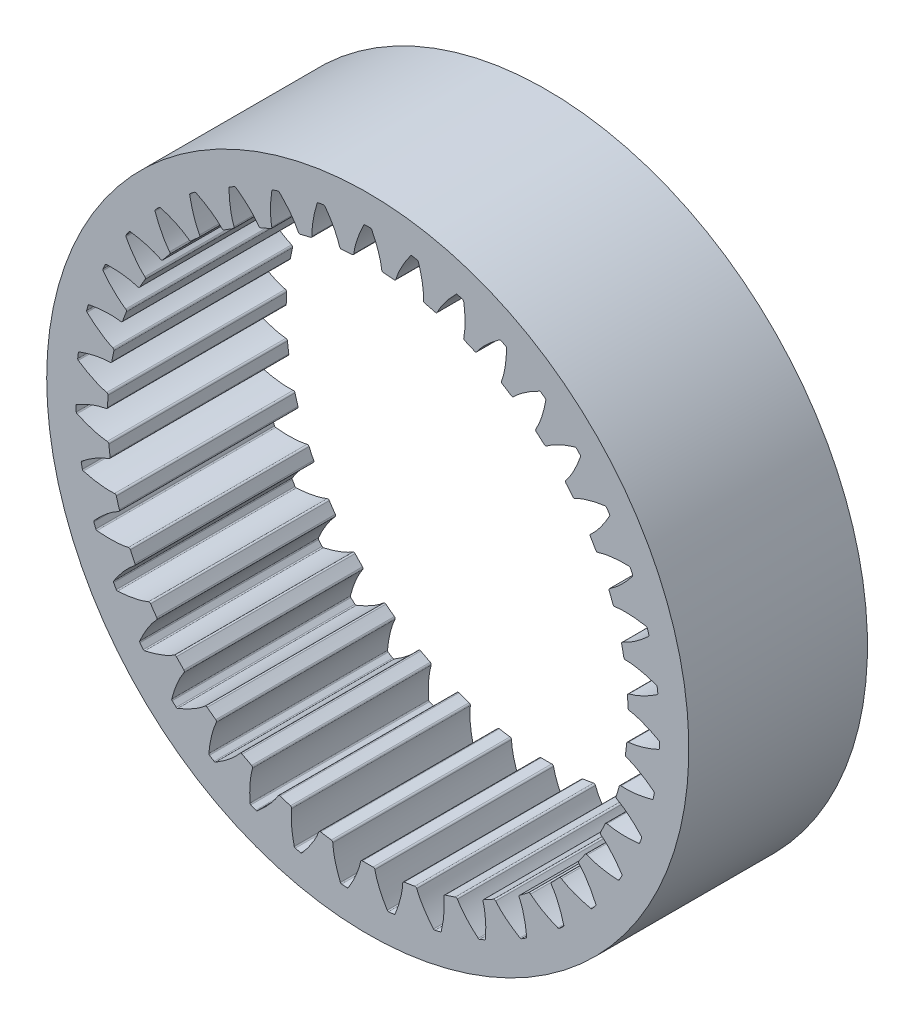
SolidWorks part; units mm, degrees
ref_plane "Front Plane" through (0, 0, 0) normal (0, 0, 1) x (1, 0, 0)
ref_plane "Top Plane" through (0, 0, 0) normal (0, 1, 0) x (1, 0, 0)
ref_plane "Right Plane" through (0, 0, 0) normal (1, 0, 0) x (0, 0, -1)
sketch "Sketch5" plane through (0, 0, 0) normal (0, 0, 1) x (1, 0, 0)
  circle A0 centre (0, 0) radius 22.825
  circle A1 centre (0, 0) radius 18.5
  dimension "Ring Gear OD" = 45.65
  dimension "Ring Gear ID" = 37
extrude "Ring Gear Blank" add sketch "Sketch5" along normal mid plane 12.7
ref_axis "Axis-Ring Gear" through (0, 0, 6.35) along (0, 0, -1)
sketch "Sketch2" plane through (0, 0, 0) normal (0, 0, 1) x (1, 0, 0)
  line L0 (0, 0) -> (-1.0106, 18.2961) construction
  line L1 (0, 20.75) -> (0, 19.5) construction
  line L2 (0, 19.5) -> (0, 18.5) construction
  line L3 (-1.0106, 18.2961) -> (-1.0033, 18.4807) construction
  line L4 (-1.0033, 18.4807) -> (-0.9816, 18.6642) construction
  line L5 (-0.9816, 18.6642) -> (-0.9505, 18.8463) construction
  line L6 (-0.9505, 18.8463) -> (-0.912, 19.027) construction
  line L7 (-0.912, 19.027) -> (-0.867, 19.2061) construction
  line L8 (-0.867, 19.2061) -> (-0.8163, 19.3838) construction
  line L9 (1.5896, 18.2549) -> (-1.0033, 18.4807) construction
  line L10 (2.6599, 18.1299) -> (-0.9816, 18.6642) construction
  line L11 (3.4751, 17.9915) -> (-0.9505, 18.8463) construction
  line L12 (4.1569, 17.8463) -> (-0.912, 19.027) construction
  line L13 (4.7527, 17.6969) -> (-0.867, 19.2061) construction
  line L14 (5.2867, 17.5448) -> (-0.8163, 19.3838) construction
  line L15 (0, 0) -> (-0.3182, 7.895) construction
  line L16 (-0.8163, 19.3838) -> (-0.7605, 19.5599) construction
  line L17 (-0.7605, 19.5599) -> (-0.7, 19.7345) construction
  line L18 (-0.7, 19.7345) -> (-0.6352, 19.9074) construction
  line L19 (-0.6352, 19.9074) -> (-0.5662, 20.0788) construction
  line L20 (-0.5662, 20.0788) -> (-0.4934, 20.2486) construction
  line L21 (-0.4934, 20.2486) -> (-0.417, 20.4168) construction
  line L22 (-0.417, 20.4168) -> (-0.3372, 20.5834) construction
  line L23 (-0.3372, 20.5834) -> (-0.2541, 20.7484) construction
  line L24 (-0.7605, 19.5599) -> (5.7735, 17.3907) construction
  line L25 (-0.7, 19.7345) -> (6.2226, 17.2351) construction
  line L26 (-0.6352, 19.9074) -> (6.6406, 17.0784) construction
  line L27 (-0.5662, 20.0788) -> (7.0324, 16.9209) construction
  line L28 (-0.4934, 20.2486) -> (7.4015, 16.7627) construction
  line L29 (-0.417, 20.4168) -> (7.7509, 16.604) construction
  line L30 (-0.3372, 20.5834) -> (8.0828, 16.445) construction
  line L31 (-0.2541, 20.7484) -> (8.3991, 16.2857) construction
  line L32 (-0.2498, 21.1626) -> (-1.3206, 17.8058) construction
  line L33 (-1.0106, 18.2961) -> (-1.0004, 18.1117) construction
  line L34 (-1.0004, 18.1117) -> (-0.9902, 17.9272) construction
  line L35 (-0.9902, 17.9272) -> (-0.9801, 17.7427) construction
  line L36 (-0.9801, 17.7427) -> (-0.9699, 17.5583) construction
  line L37 (-0.9699, 17.5583) -> (-0.9597, 17.3738) construction
  line L38 (-0.9597, 17.3738) -> (-0.9495, 17.1894) construction
  arc A0 (-1.0106, 18.2961) -> (5.7735, 17.3907) centre (0, 0) cw construction
  arc A1 (6.2226, 17.2351) -> (-1.0106, 18.2961) centre (0, 0) ccw construction
  circle A2 centre (0, 0) radius 18.324 construction
  circle A3 centre (0, 0) radius 18.5 construction
  arc A4 (-1.0106, 18.2961) -> (6.6406, 17.0784) centre (0, 0) cw construction
  arc A5 (-1.0106, 18.2961) -> (1.5896, 18.2549) centre (0, 0) cw construction
  arc A6 (2.6599, 18.1299) -> (-1.0106, 18.2961) centre (0, 0) ccw construction
  arc A7 (3.4751, 17.9915) -> (-1.0106, 18.2961) centre (0, 0) ccw construction
  arc A8 (4.1569, 17.8463) -> (-1.0106, 18.2961) centre (0, 0) ccw construction
  arc A9 (-1.0106, 18.2961) -> (4.7527, 17.6969) centre (0, 0) cw construction
  arc A10 (-1.0106, 18.2961) -> (5.2867, 17.5448) centre (0, 0) cw construction
  arc A11 (-1.0106, 18.2961) -> (7.0324, 16.9209) centre (0, 0) cw construction
  arc A12 (7.4015, 16.7627) -> (-1.0106, 18.2961) centre (0, 0) ccw construction
  arc A13 (7.7509, 16.604) -> (-1.0106, 18.2961) centre (0, 0) ccw construction
  arc A14 (-1.0106, 18.2961) -> (8.0828, 16.445) centre (0, 0) cw construction
  arc A15 (-1.0106, 18.2961) -> (8.3991, 16.2857) centre (0, 0) cw construction
  circle A16 centre (0, 0) radius 19.5 construction
  circle A17 centre (0, 0) radius 20.75 construction
  arc A18 (-0.7852, 19.4842) -> (0.7852, 19.4842) centre (0, 0) cw construction
  arc A19 (0.2541, 20.7484) -> (-0.2541, 20.7484) centre (0, 0) ccw
  arc A20 (0.5053, 9.1481) -> (-0.5053, 9.1481) centre (0, 0) cw
  spline S0 degree 3 poles (-0.2541, 20.7484) (-0.3106, 20.639) (-0.3921, 20.4732) (-0.494, 20.2489) (-0.5669, 20.0791) (-0.6358, 19.9077) (-0.7008, 19.7347) (-0.7613, 19.5602) (-0.8172, 19.3841) (-0.8679, 19.2064) (-0.913, 19.0272) (-0.9518, 18.8465) (-0.9831, 18.6644) (-1.0056, 18.481) (-1.0147, 18.296) (-0.9993, 18.1117) (-0.9905, 17.9272) (-0.98, 17.7427) (-0.9699, 17.5583) (-0.8113, 14.6934) (-0.6647, 11.8898) (-0.5053, 9.1481) knots 0 0 0 0 0.03145 0.047175 0.062899 0.078624 0.094349 0.110074 0.125799 0.141524 0.157249 0.172973 0.188698 0.204423 0.220148 0.235873 0.251598 0.267322 0.283047 0.298772 1 1 1 1
  spline S1 degree 3 poles (0.2541, 20.7484) (0.3106, 20.639) (0.3921, 20.4732) (0.494, 20.2489) (0.5669, 20.0791) (0.6358, 19.9077) (0.7008, 19.7347) (0.7613, 19.5602) (0.8172, 19.3841) (0.8679, 19.2064) (0.913, 19.0272) (0.9518, 18.8465) (0.9831, 18.6644) (1.0056, 18.481) (1.0147, 18.296) (0.9993, 18.1117) (0.9905, 17.9272) (0.98, 17.7427) (0.9699, 17.5583) (0.8113, 14.6934) (0.6647, 11.8898) (0.5053, 9.1481) knots 0 0 0 0 0.03145 0.047175 0.062899 0.078624 0.094349 0.110074 0.125799 0.141524 0.157249 0.172973 0.188698 0.204423 0.220148 0.235873 0.251598 0.267322 0.283047 0.298772 1 1 1 1
  point P8 (-1.0106, 18.2961)
  point P44 (-0.7852, 19.4842)
  dimension "Pitch Dia" = 39
  dimension "Base Circle" = 36.648
  dimension "Root_Diameter" = 37
  dimension "Outside_Diameter" = 41.5
  dimension "Addendum" = 1
  dimension "PressAngle_Measured" = 20
  dimension "Dedendum" = 1.25
  dimension "Tooth_Depth" = 2.25
  dimension "Tooth Width" = 1.5708
extrude "First Tooth" cut sketch "Sketch2" against normal through all both and the other way through all
fillet "Tip Radius" radius 0.125 2 edges at (-1.004, 18.4727, 0) (1.004, 18.4727, 0)
fillet "Root Fillet" radius 0.1 2 edges at (-0.2541, 20.7484, 0) (0.2541, 20.7484, 0)
pattern_circular "Teeth" count 39 over 360 about axis through (0, 0, 6.35) along (0, 0, -1) of "First Tooth", "Tip Radius", "Root Fillet"
